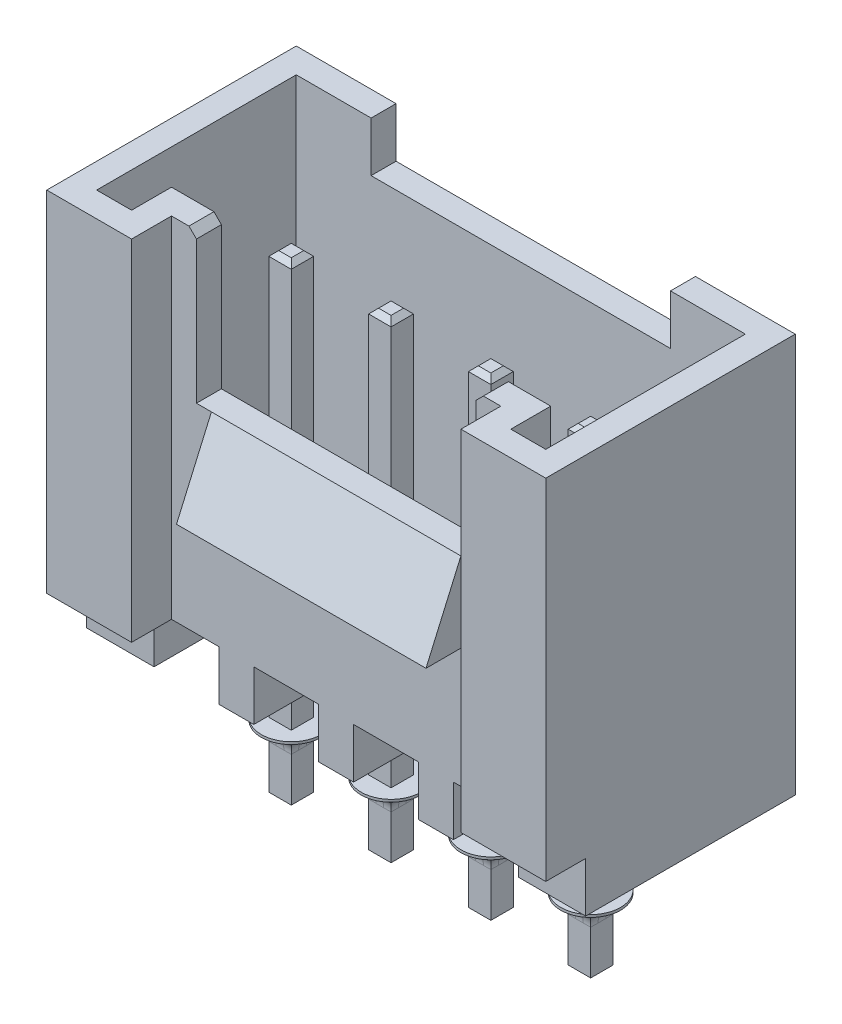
SolidWorks part; units mm, degrees
ref_plane "Plan de face" through (0, 0, 0) normal (0, 0, 1) x (1, 0, 0)
ref_plane "Plan de dessus" through (0, 0, 0) normal (0, 1, 0) x (1, 0, 0)
ref_plane "Plan de droite" through (0, 0, 0) normal (1, 0, 0) x (0, 0, -1)
sketch "Esquisse1" plane through (0, 0, 0) normal (0, 1, 0) x (1, 0, 0)
  line L1 (-5, 0) -> (5, 0)
  line L2 (-5, 0) -> (-5, 5)
  line L3 (-5, 5) -> (5, 5)
  line L4 (5, 0) -> (5, 5)
  dimension "D1" = 10
  dimension "D2" = 5
extrude "Boss.-Extru.1" add sketch "Esquisse1" along normal blind 8
sketch "Esquisse7" plane through (5, 0, 0) normal (1, 0, 0) x (0, 0, -1)
  line L1 (0, 0) -> (0.8, 0)
  line L2 (0, 0) -> (0, 1)
  line L3 (0, 1) -> (0.8, 1)
  line L4 (0.8, 0) -> (0.8, 1)
  dimension "D1" = 0.8
  dimension "D2" = 1
extrude "Enlèv. mat.-Extru.5" cut sketch "Esquisse7" against normal through all
ref_plane "Plan1" through (3, 0, 0) normal (1, 0, 0) x (0, 0, -1)
sketch "Esquisse8" plane through (3, 0, 0) normal (1, 0, 0) x (0, 0, -1)
  line L0 (0.8, 1) -> (1.1, 1)
  line L1 (1.1, 1) -> (1.9, 0.2)
  line L2 (1.9, 0.2) -> (3.9, 0.2)
  line L3 (3.9, 0.2) -> (4.7, 1)
  line L4 (4.7, 1) -> (5, 1)
  line L5 (5, 8) -> (5, 0) construction
  line L6 (5, 1) -> (5, 0)
  line L7 (5, 0) -> (0.8, 0)
  line L8 (0.8, 0) -> (0.8, 1)
  line L9 (0.8, 0) -> (0.8, 1) construction
  dimension "D1" = 0.2
  dimension "D2" = 0.3
  dimension "D3" = 45
extrude "Enlèv. mat.-Extru.6" cut sketch "Esquisse8" against normal mid plane 1.3
pattern_linear "Répétition linéaire3" count 4 spacing 2 along (-1, 0, 0) of "Enlèv. mat.-Extru.6"
sketch "Esquisse2" plane through (0, 8, 0) normal (0, 1, 0) x (1, 0, 0)
  line L0 (-5, 0) -> (5, 0) construction
  line L1 (-3.3, -0.8) -> (3.3, -0.8)
  line L2 (-3.3, -0.8) -> (-3.3, 0.8)
  line L3 (-3.3, 0.8) -> (3.3, 0.8)
  line L4 (3.3, -0.8) -> (3.3, 0.8)
  line L5 (-3.3, -0.8) -> (3.3, 0.8) construction
  line L6 (-3.3, 0.8) -> (3.3, -0.8) construction
  line L7 (5, 0) -> (5, 5) construction
  point P0 (0, 0)
  dimension "D1" = 0.8
  dimension "D2" = 1.7
extrude "Enlèv. mat.-Extru.1" cut sketch "Esquisse2" against normal through all
sketch "Esquisse4" plane through (0, 8, 0) normal (0, 1, 0) x (1, 0, 0)
  line L16 (-3.8, 1.3) -> (3.8, 1.3)
  line L17 (3.8, 1.3) -> (3.8, 0.5)
  line L18 (3.8, 0.5) -> (4.5, 0.5)
  line L19 (4.5, 0.5) -> (4.5, 4.5)
  line L20 (4.5, 4.5) -> (-4.5, 4.5)
  line L21 (-4.5, 4.5) -> (-4.5, 0.5)
  line L22 (-4.5, 0.5) -> (-3.8, 0.5)
  line L23 (-3.8, 0.5) -> (-3.8, 1.3)
  line L24 (-3.8, 1.3) -> (3.8, 1.3)
  line L25 (3.8, 1.3) -> (3.8, 0.5)
  line L26 (3.8, 0.5) -> (4.5, 0.5)
  line L27 (4.5, 0.5) -> (4.5, 4.5)
  line L28 (4.5, 4.5) -> (-4.5, 4.5)
  line L29 (-4.5, 4.5) -> (-4.5, 0.5)
  line L30 (-4.5, 0.5) -> (-3.8, 0.5)
  line L31 (-3.8, 0.5) -> (-3.8, 1.3)
  dimension "D1" = 0.5
extrude "Enlèv. mat.-Extru.2" cut sketch "Esquisse4" against normal blind 6.5
sketch "Esquisse5" plane through (0, 8, 0) normal (0, 1, 0) x (1, 0, 0)
  line L0 (4.5, 4.5) -> (-4.5, 4.5) construction
  line L1 (-3, 4) -> (3, 4)
  line L2 (-3, 4) -> (-3, 5)
  line L3 (-3, 5) -> (3, 5)
  line L4 (3, 4) -> (3, 5)
  line L5 (-3, 4) -> (3, 5) construction
  line L6 (-3, 5) -> (3, 4) construction
  line L7 (5, 5) -> (-5, 5) construction
  line L8 (5, 0) -> (5, 5) construction
  point P0 (0, 4.5)
  dimension "D1" = 2
extrude "Enlèv. mat.-Extru.3" cut sketch "Esquisse5" against normal blind 1
sketch "Esquisse6" plane through (0, 8, 0) normal (0, 1, 0) x (1, 0, 0)
  line L0 (3.3, 0.8) -> (-3.3, 0.8) construction
  line L1 (-2.8, 0.3) -> (2.8, 0.3)
  line L2 (-2.8, 0.3) -> (-2.8, 1.3)
  line L3 (-2.8, 1.3) -> (2.8, 1.3)
  line L4 (2.8, 0.3) -> (2.8, 1.3)
  line L5 (-2.8, 0.3) -> (2.8, 1.3) construction
  line L6 (-2.8, 1.3) -> (2.8, 0.3) construction
  line L7 (-3.8, 1.3) -> (3.8, 1.3) construction
  line L8 (5, 0) -> (5, 5) construction
  point P0 (0, 0.8)
  dimension "D1" = 2.2
extrude "Enlèv. mat.-Extru.4" cut sketch "Esquisse6" against normal blind 3
sketch "Esquisse11" plane through (0, 0, 0) normal (1, 0, 0) x (0, 0, -1)
  line L0 (0.8, 5) -> (0.1, 3.4)
  line L1 (0.8, 5) -> (0.8, 8) construction
  line L2 (1.3, 5) -> (0.8, 5) construction
  line L3 (0.1, 3.4) -> (0.8, 3.4)
  line L4 (0.8, 1) -> (0.8, 8) construction
  line L5 (0.8, 3.4) -> (0.8, 5)
  dimension "D1" = 0.7
  dimension "D2" = 1.6
extrude "Boss.-Extru.2" add sketch "Esquisse11" along normal mid plane 5
chamfer "Chanfrein1" distance 0.15 angle 45 2 edges at (2.8, 8, -1.05) (-2.8, 8, -1.05)
sketch "Esquisse16" plane through (3, 0, 0) normal (-1, 0, 0) x (0, 0, 1)
  line L0 (-2.9, 6.5) -> (-2.9, -3)
  line L2 (-3.9, 0.2) -> (-1.9, 0.2) construction
  point P2 (-2.9, 0.2)
  dimension "D1" = 3.2
  dimension "D2" = 6.3
extrude "Extru.-Mince2" add sketch "Esquisse16" along normal mid plane 0.45 separate body thin
chamfer "Chanfrein4" distance 0.1 angle 45 8 edges at (3, -3, -2.675) (3, -3, -3.125) (2.775, -3, -2.9) (3.225, -3, -2.9) (3, 6.5, -3.125) (3, 6.5, -2.675) (2.775, 6.5, -2.9) (3.225, 6.5, -2.9)
ref_plane "Plan2" through (0, -1.6, 0) normal (0, -1, 0) x (-1, 0, 0)
sketch "Esquisse17" plane through (0, -1.6, 0) normal (0, -1, 0) x (-1, 0, 0)
  line L0 (-3.225, 2.675) -> (-2.775, 3.125) construction
  circle A0 centre (-3, 2.9) radius 0.6
extrude "Boss.-Extru.3" add sketch "Esquisse17" along normal blind 0.05
fillet "Congé1" radius 0.37 4 edges at (3.225, -1.65, -2.9) (3, -1.65, -3.125) (3, -1.65, -2.675) (2.775, -1.65, -2.9)
pattern_linear "Répétition linéaire4" count 4 spacing 2 along (-1, 0, 0)
